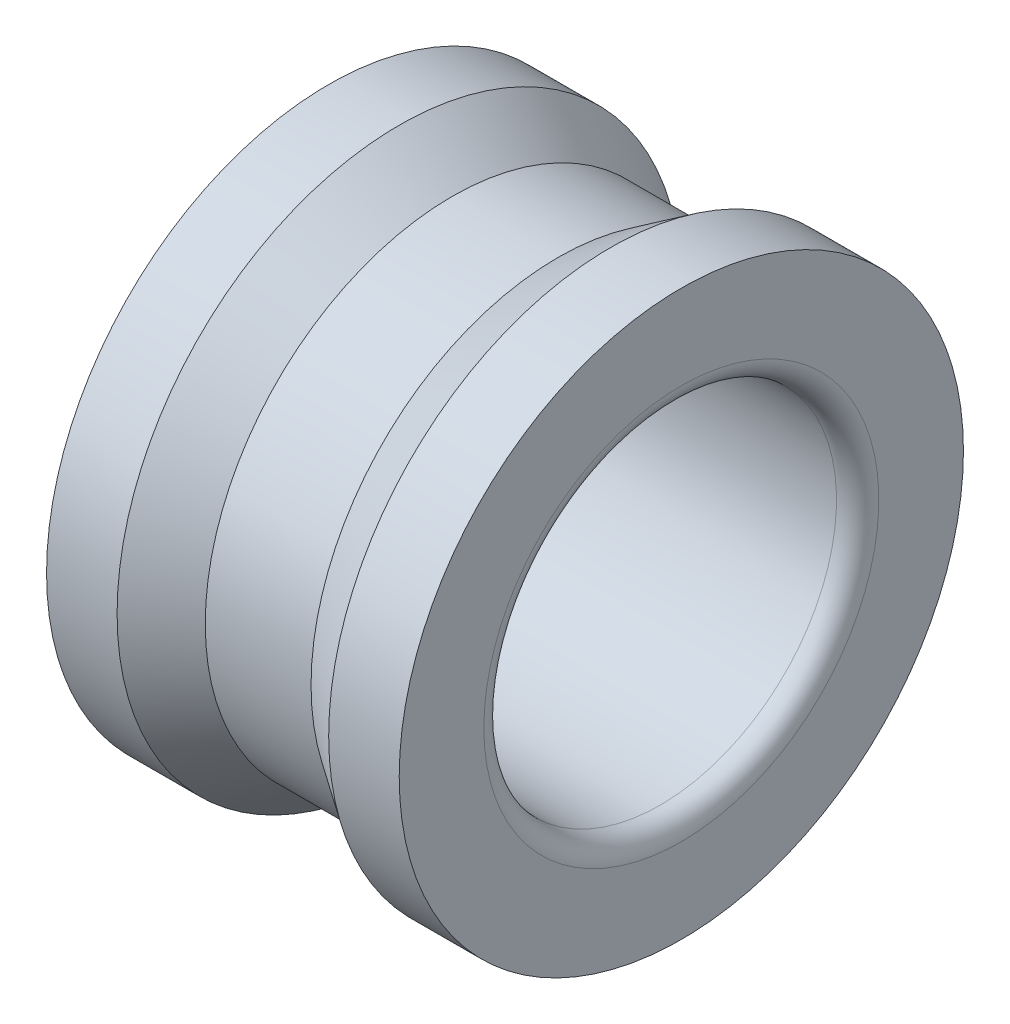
SolidWorks part; units mm, degrees
ref_plane "Front Plane" through (0, 0, 0) normal (0, 0, 1) x (1, 0, 0)
ref_plane "Top Plane" through (0, 0, 0) normal (0, 1, 0) x (1, 0, 0)
ref_plane "Right Plane" through (0, 0, 0) normal (1, 0, 0) x (0, 0, -1)
sketch "Sketch2" plane through (0, 0, 0) normal (0, 0, 1) x (1, 0, 0)
  line L0 (-2.5, 2.5) -> (2.5, 2.5)
  line L1 (2.5, 2.5) -> (2.5, 4)
  line L2 (2.5, 4) -> (1.5, 4)
  line L3 (1.5, 4) -> (0.75, 3.5)
  line L4 (0.75, 3.5) -> (-0.75, 3.5)
  line L5 (-0.75, 3.5) -> (-1.5, 4)
  line L6 (-1.5, 4) -> (-2.5, 4)
  line L7 (-2.5, 4) -> (-2.5, 2.5)
  line L8 (-2.5, 0) -> (2.5, 0) construction
  point P11 (0, 2.5)
  point P12 (0, 3.5)
  dimension "D1" = 3.5
  dimension "D2" = 5
  dimension "D3" = 1.5
  dimension "D4" = 1.5
  dimension "D5" = 1
  dimension "D6" = 1
revolve "Revolve1" add sketch "Sketch2" angle 360 about L8
fillet "Fillet1" radius 0.3 2 edges at (-2.5, 0, 2.5) (2.5, 0, 2.5)
